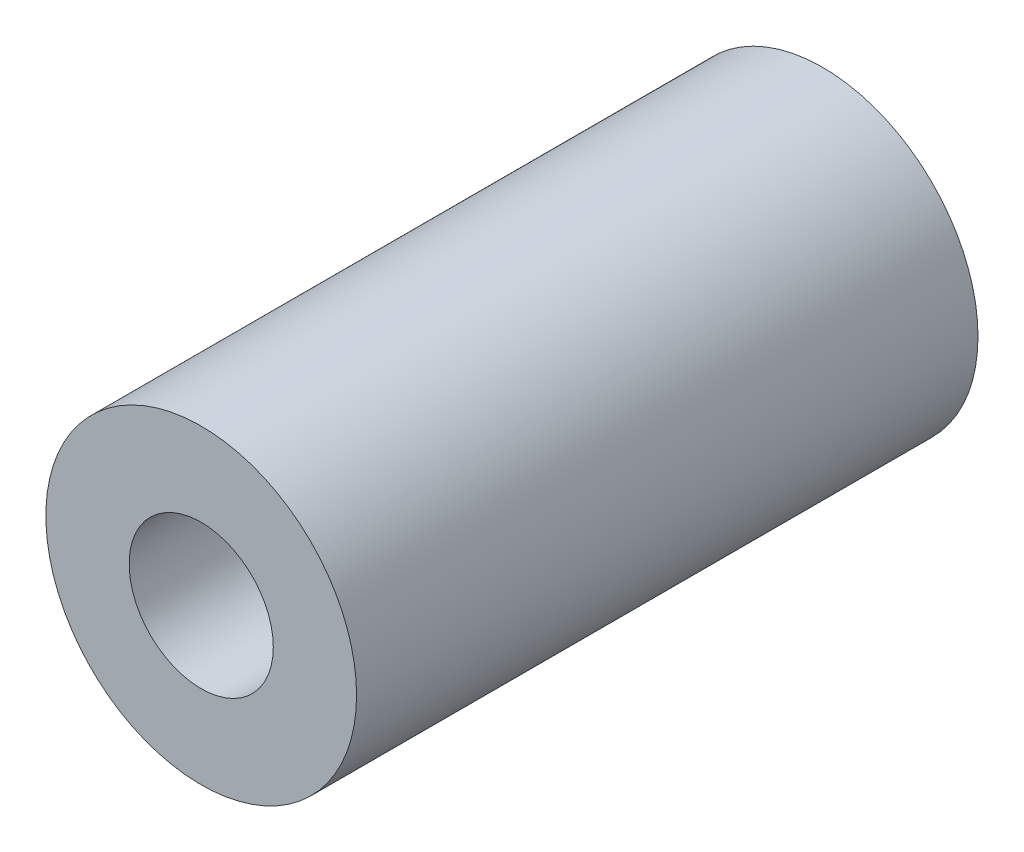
SolidWorks part; units mm, degrees
ref_plane "Front Plane" through (0, 0, 0) normal (0, 0, 1) x (1, 0, 0)
ref_plane "Top Plane" through (0, 0, 0) normal (0, 1, 0) x (1, 0, 0)
ref_plane "Right Plane" through (0, 0, 0) normal (1, 0, 0) x (0, 0, -1)
sketch "Sketch1" plane through (0, 0, 0) normal (0, 0, 1) x (1, 0, 0)
  circle A0 centre (0, 0) radius 3.175
  dimension "D1" = 6.35
extrude "Boss-Extrude1" add sketch "Sketch1" along normal blind 12.7
hole_wizard "#4 Clearance Hole1" positions "Sketch3" profile "Sketch2" hole size "#4" standard "ANSI Inch"
sketch "Sketch3" plane through (0, 0, 12.7) normal (0, 0, 1) x (1, 0, 0)
  point P0 (0, 0)
sketch "Sketch2" plane through (0, 0, 12.7) normal (1, 0, 0) x (0, -1, 0)
  line L0 (0, 0) -> (0, 12.7)
  line L1 (0, 12.7) -> (1.4732, 12.7)
  line L2 (1.4732, 12.7) -> (1.4732, 0)
  line L5 (1.4732, 0) -> (0, 0)
  line L11 (0, -6.35) -> (0, 107.95) construction
  dimension "Thru Hole Dia." = 2.9464
  dimension "Thru Hole Depth" = 12.7
